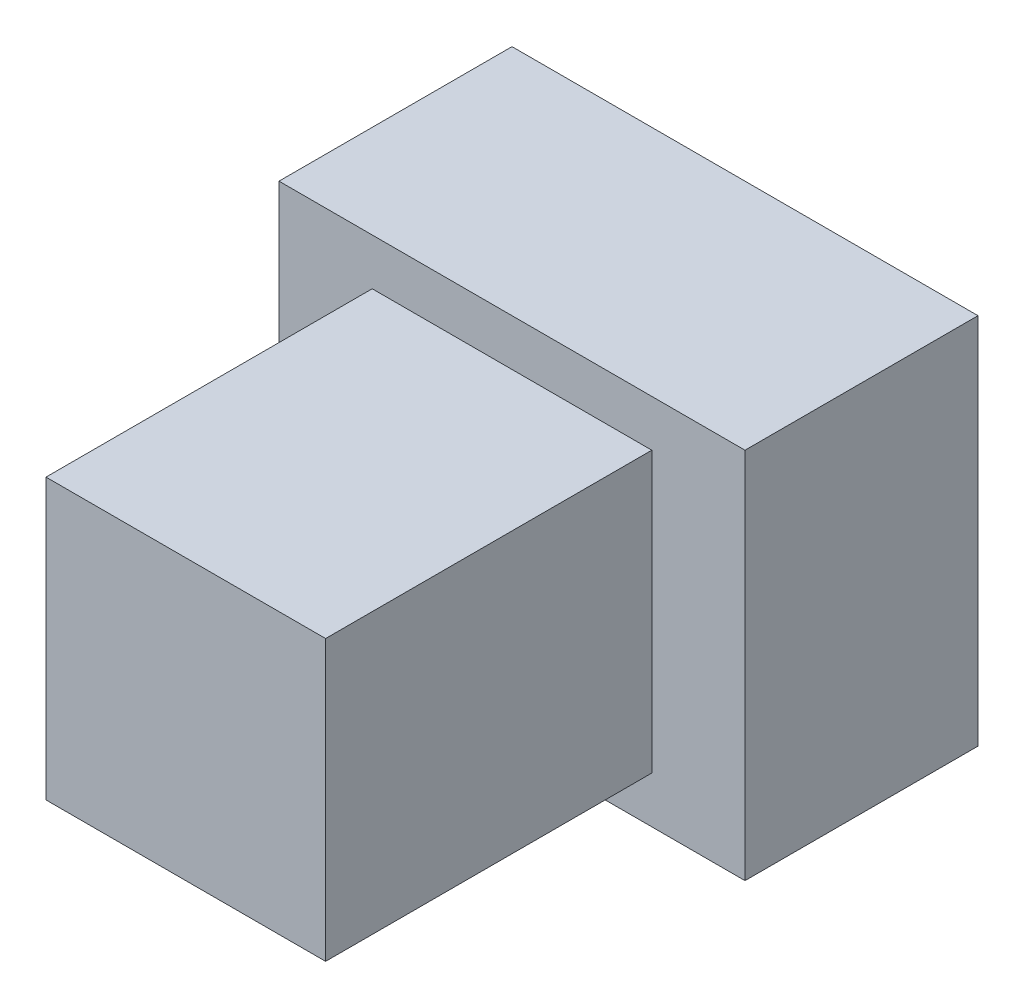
SolidWorks part; units mm, degrees
ref_plane "Alzado" through (0, 0, 0) normal (0, 0, 1) x (1, 0, 0)
ref_plane "Planta" through (0, 0, 0) normal (0, 1, 0) x (1, 0, 0)
ref_plane "Vista lateral" through (0, 0, 0) normal (1, 0, 0) x (0, 0, -1)
sketch "Croquis1" plane through (0, 0, 0) normal (0, 0, 1) x (1, 0, 0)
  line L0 (0, -44) -> (0, 44) construction
  line L1 (-50, 40) -> (50, 40)
  line L2 (-50, 40) -> (-50, -40)
  line L3 (-50, -40) -> (50, -40)
  line L4 (50, 40) -> (50, -40)
  line L5 (55, 0) -> (-55, 0) construction
  dimension "D1" = 100
  dimension "D2" = 50
  dimension "D3" = 80
  dimension "D4" = 40
extrude "Saliente-Extruir1" add sketch "Croquis1" along normal blind 50
sketch "Croquis2" plane through (0, 0, 50) normal (0, 0, 1) x (1, 0, 0)
  line L1 (-30, 30) -> (30, 30)
  line L2 (-30, 30) -> (-30, -30)
  line L3 (-30, -30) -> (30, -30)
  line L4 (30, 30) -> (30, -30)
  line L5 (0, -44) -> (0, 44) construction
  line L6 (55, 0) -> (-55, 0) construction
  dimension "D1" = 60
  dimension "D2" = 30
  dimension "D3" = 60
  dimension "D4" = 30
extrude "Saliente-Extruir2" add sketch "Croquis2" along normal blind 70
